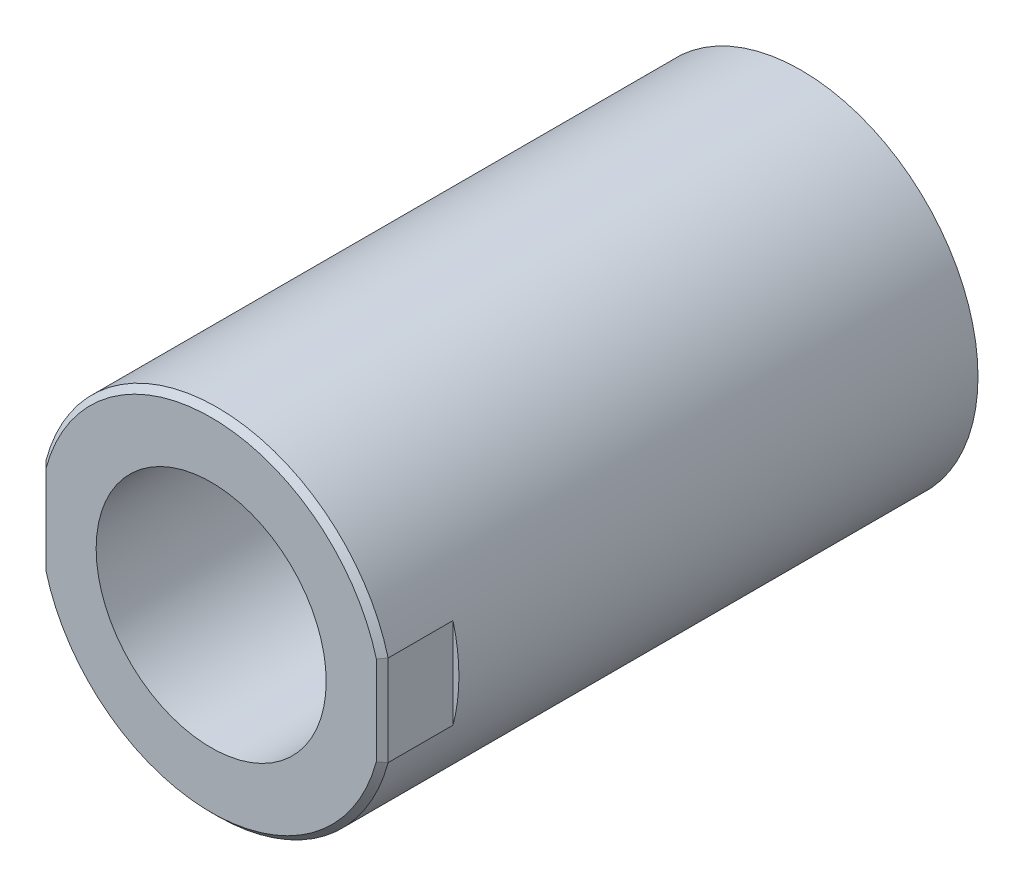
SolidWorks part; units mm, degrees
ref_plane "Front Plane" through (0, 0, 0) normal (0, 0, 1) x (1, 0, 0)
ref_plane "Top Plane" through (0, 0, 0) normal (0, 1, 0) x (1, 0, 0)
ref_plane "Right Plane" through (0, 0, 0) normal (1, 0, 0) x (0, 0, -1)
sketch "Sketch1" plane through (0, 0, 0) normal (0, 0, 1) x (1, 0, 0)
  circle A0 centre (0, 0) radius 30
  dimension "D1" = 60
extrude "S" add sketch "Sketch1" against normal blind 100
sketch "Sketch2" plane through (0, 0, 0) normal (0, 0, 1) x (1, 0, 0)
  circle A0 centre (0, 0) radius 30
  circle A1 centre (0, 0) radius 30 construction
  dimension "D1" = 60
extrude "L2" add sketch "Sketch2" along normal blind 15
hole_wizard "( T1xL4 ) M30x1.5 Tapped Hole1 " positions "3DSketch1" profile "Sketch5" tap size "M42x3.0" standard "Ansi Metric"
sketch3d "3DSketch1"
  circle A0 centre (0, 0, 15) radius 30 construction
  point P0 (0, 0, 15)
  point P5 (0, 0, 45)
sketch "Sketch5" plane through (0, 0, 15) normal (1, 0, 0) x (0, -1, 0)
  line L0 (0, 0) -> (0, 62.7168)
  line L1 (0, 62.7168) -> (19.5, 51)
  line L2 (19.5, 51) -> (19.5, 0)
  line L5 (19.5, 0) -> (0, 0)
  line L10 (0, 62.7168) -> (-19.5, 51) construction
  line L11 (0, -6.35) -> (0, 107.95) construction
  dimension "Tap Drill Dia." = 39
  dimension "Tap Drill Depth" = 51
  dimension "Drill Angle" = 118
chamfer "Chamfer2" distance 0.5 angle 45 1 edges at (30, 0, 15)
sketch "Sketch6" plane through (0, 0, 0) normal (0, 0, 1) x (1, 0, 0)
  circle A0 centre (0, 0) radius 29.5
  circle A1 centre (0, 0) radius 30
  circle A2 centre (0, 0) radius 30 construction
  circle A4 centre (0, 0) radius 30 construction
  dimension "D1" = 60
  dimension "D2" = 59
  dimension "D3" = 60
extrude "U/C" cut sketch "Sketch6" along normal blind 1
sketch "Sketch7" plane through (0, 0, 0) normal (0, 1, 0) x (1, 0, 0)
  line L1 (29, 0) -> (31.5, 0)
  line L2 (29, 0) -> (29, 12)
  line L3 (29, 12) -> (31.5, 12)
  line L4 (31.5, 0) -> (31.5, 12)
  line L5 (-31.5, 0) -> (-29, 0)
  line L6 (-31.5, 0) -> (-31.5, 12)
  line L7 (-31.5, 12) -> (-29, 12)
  line L8 (-29, 0) -> (-29, 12)
  line L12 (0, -1) -> (0, -14.5) construction
  line L13 (-30, 100) -> (30, 100) construction
  line L14 (0, 0) -> (0, -15) construction
  line L15 (0, 36) -> (0, -15) construction
  line L16 (-29.5, -15) -> (29.5, -15) construction
  dimension "D1" = 12
  dimension "D2" = 58
  dimension "D3" = 29
  dimension "D4" = 63
  dimension "D5" = 31.5
  dimension "D6" = 60
  dimension "D7" = 15
extrude "A/F" cut sketch "Sketch7" against normal mid plane 21
sketch "Sketch8" plane through (0, 0, 0) normal (0, 1, 0) x (1, 0, 0)
  line L1 (-37.5191, 0) -> (34.4528, 0)
  line L2 (-37.5191, 0) -> (-37.5191, -18.5608)
  line L3 (-37.5191, -18.5608) -> (34.4528, -18.5608)
  line L4 (34.4528, 0) -> (34.4528, -18.5608)
extrude "Cut-Extrude1" cut sketch "Sketch8" against normal mid plane 80
chamfer "Chamfer3" distance 1 angle 45 4 edges at (29, 0, 0) (0, 30, 0) (0, -30, 0) (-29, 0, 0)
equation "\"D2@Sketch6\" =\"D3@Sketch6\" - 1"
equation "\"D1@Sketch6\" = \"D3@Sketch6\""
equation "\"D2@Sketch7\" = \"D6@Sketch7\" - 2"
equation "\"D3@Sketch7\" = \"D2@Sketch7\" / 2"
equation "\"D4@Sketch7\" = \"D2@Sketch7\"+5"
equation "\"D5@Sketch7\" = \"D4@Sketch7\"/2"
equation "\"D1@Sketch7\" = \"D7@Sketch7\"-3"
